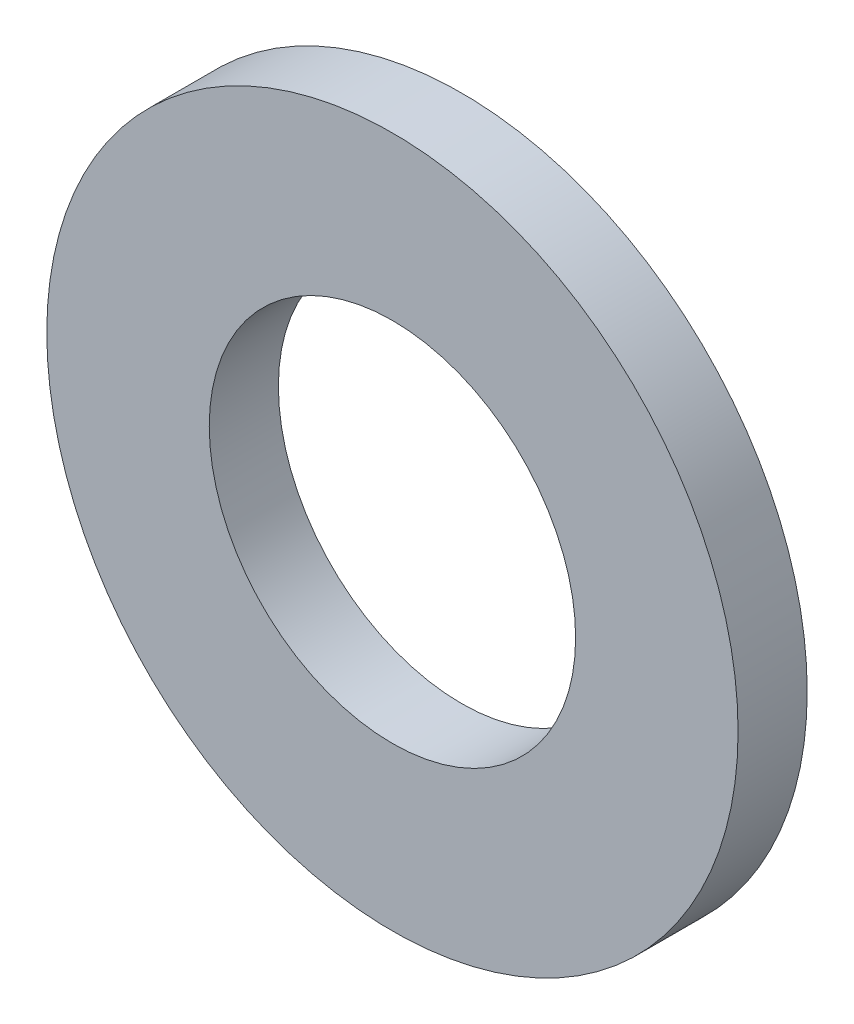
SolidWorks part; units mm, degrees
ref_plane "Ebene vorne" through (0, 0, 0) normal (0, 0, 1) x (1, 0, 0)
ref_plane "Ebene oben" through (0, 0, 0) normal (0, 1, 0) x (1, 0, 0)
ref_plane "Ebene rechts" through (0, 0, 0) normal (1, 0, 0) x (0, 0, -1)
sketch "Skizze1" plane through (0, 0, 0) normal (0, 0, 1) x (1, 0, 0)
  circle A0 centre (0, 0) radius 2.65
  circle A1 centre (0, 0) radius 5
  dimension "D1" = 5.3
  dimension "D2" = 10
extrude "Aufsatz-Linear austragen1" add sketch "Skizze1" along normal blind 1
